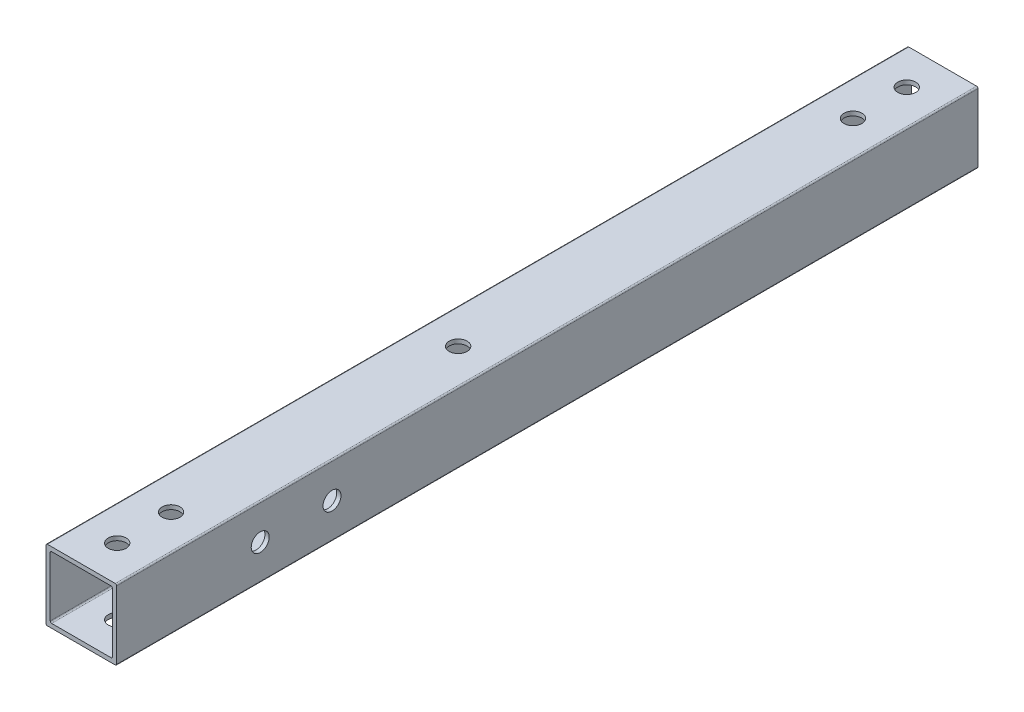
SolidWorks part; units mm, degrees
ref_plane "Front Plane" through (0, 0, 0) normal (0, 0, 1) x (1, 0, 0)
ref_plane "Top Plane" through (0, 0, 0) normal (0, 1, 0) x (1, 0, 0)
ref_plane "Right Plane" through (0, 0, 0) normal (1, 0, 0) x (0, 0, -1)
ref_plane "Plane1" through (0, 0, -2000) normal (0, 0, -1) x (-1, 0, 0)
sketch "Sketch1" plane through (0, 0, -2000) normal (0, 0, -1) x (-1, 0, 0)
  line L0 (11, 10.5) -> (11, -10.5)
  line L1 (10.5, -11) -> (-10.5, -11)
  line L2 (-11, -10.5) -> (-11, 10.5)
  line L3 (-10.5, 11) -> (10.5, 11)
  line L4 (12.5, -12) -> (12.5, 12)
  line L5 (12, 12.5) -> (-12, 12.5)
  line L6 (-12.5, 12) -> (-12.5, -12)
  line L7 (-12, -12.5) -> (12, -12.5)
  line L8 (0, 12.5) -> (0, -12.5) construction
  line L9 (-12.5, 0) -> (12.5, 0) construction
  arc A0 (11, -10.5) -> (10.5, -11) centre (10.5, -10.5) cw
  arc A1 (-10.5, -11) -> (-11, -10.5) centre (-10.5, -10.5) cw
  arc A2 (-11, 10.5) -> (-10.5, 11) centre (-10.5, 10.5) cw
  arc A3 (10.5, 11) -> (11, 10.5) centre (10.5, 10.5) cw
  arc A4 (12.5, 12) -> (12, 12.5) centre (12, 12) ccw
  arc A5 (-12, 12.5) -> (-12.5, 12) centre (-12, 12) ccw
  arc A6 (-12.5, -12) -> (-12, -12.5) centre (-12, -12) ccw
  arc A7 (12, -12.5) -> (12.5, -12) centre (12, -12) ccw
  dimension "D7" = 0.5
  dimension "D8" = 0.5
  dimension "D9" = 0.5
  dimension "D10" = 0.5
  dimension "D11" = 0.5
  dimension "D1" = 25
  dimension "D2" = 25
  dimension "D3" = 1.5
  dimension "D4" = 1.5
  dimension "D5" = 1.5
  dimension "D6" = 1.5
extrude "Boss-Extrude1" add sketch "Sketch1" against normal blind 304.8
sketch "Sketch2" plane through (0, 12.5, 0) normal (0, 1, 0) x (1, 0, 0)
  line L0 (0, 2000) -> (0, 1695.2) construction
  line L1 (-12, 2000) -> (12, 2000) construction
  line L2 (-12, 1695.2) -> (12, 1695.2) construction
  line L3 (-12, 1847.6) -> (12, 1847.6) construction
  line L4 (-12, 1695.2) -> (-12, 2000) construction
  line L5 (12, 1695.2) -> (12, 2000) construction
  circle A0 centre (0, 1987.3) radius 3.175
  circle A1 centre (0, 1968.25) radius 3.175
  circle A2 centre (0, 1707.9) radius 3.175
  circle A3 centre (0, 1726.95) radius 3.175
  dimension "D3" = 6.35
  dimension "D4" = 6.35
  dimension "D1" = 12.7
  dimension "D2" = 31.75
extrude "Cut-Extrude1" cut sketch "Sketch2" against normal up to surface (25 mm away)
sketch "Sketch3" plane through (12.5, 0, 0) normal (1, 0, 0) x (0, 0, -1)
  line L0 (1695.2, 0) -> (2000, 0) construction
  line L1 (1695.2, 12) -> (1695.2, -12) construction
  line L2 (2000, 12) -> (2000, -12) construction
  circle A0 centre (1771.4, 0) radius 3.175
  circle A1 centre (1746, 0) radius 3.175
  dimension "D1" = 6.35
  dimension "D2" = 6.35
  dimension "D3" = 25.4
  dimension "D4" = 50.8
extrude "Cut-Extrude2" cut sketch "Sketch3" against normal up to surface (25 mm away)
sketch "Sketch4" plane through (0, 12.5, 0) normal (0, 1, 0) x (1, 0, 0)
  line L0 (0, 2000) -> (0, 1695.2) construction
  line L1 (-12, 2000) -> (12, 2000) construction
  line L2 (-12, 1695.2) -> (12, 1695.2) construction
  circle A0 centre (0, 1828.55) radius 3.175
  dimension "D1" = 6.35
  dimension "D3" = 171.45
extrude "Cut-Extrude3" cut sketch "Sketch4" against normal up to surface (25 mm away)
